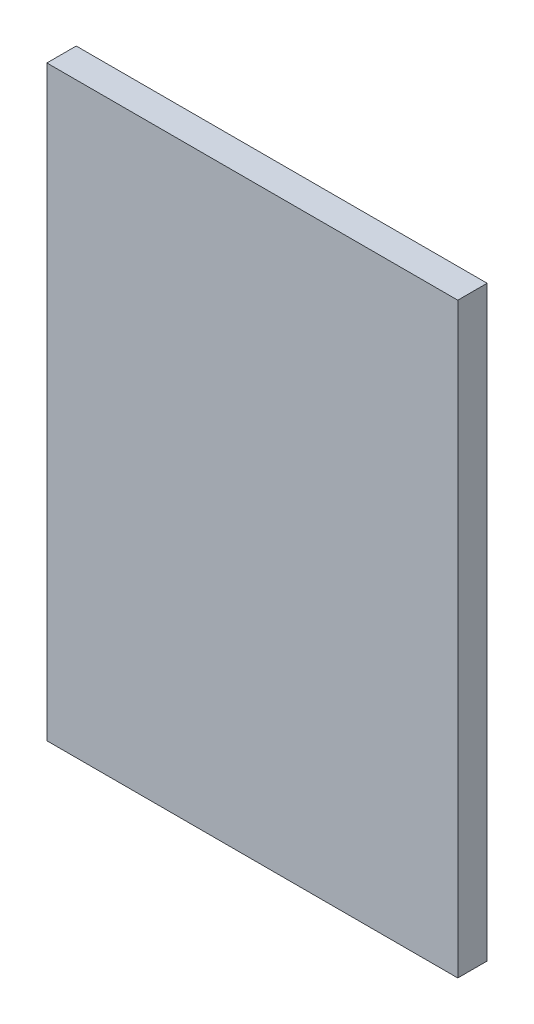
SolidWorks part; units mm, degrees
ref_plane "Ebene vorne" through (0, 0, 0) normal (0, 0, 1) x (1, 0, 0)
ref_plane "Ebene oben" through (0, 0, 0) normal (0, 1, 0) x (1, 0, 0)
ref_plane "Ebene rechts" through (0, 0, 0) normal (1, 0, 0) x (0, 0, -1)
sketch "Skizze1" plane through (0, 0, 0) normal (0, 0, 1) x (1, 0, 0)
  line L1 (-70, 0) -> (70, 0)
  line L2 (-70, 0) -> (-70, 200)
  line L3 (-70, 200) -> (70, 200)
  line L4 (70, 0) -> (70, 200)
  dimension "D1" = 140
  dimension "D2" = 200
extrude "Linear austragen1" add sketch "Skizze1" along normal blind 10
ref_plane "Ebene1" through (0, 100, 0) normal (0, 1, 0) x (-1, 0, 0)
